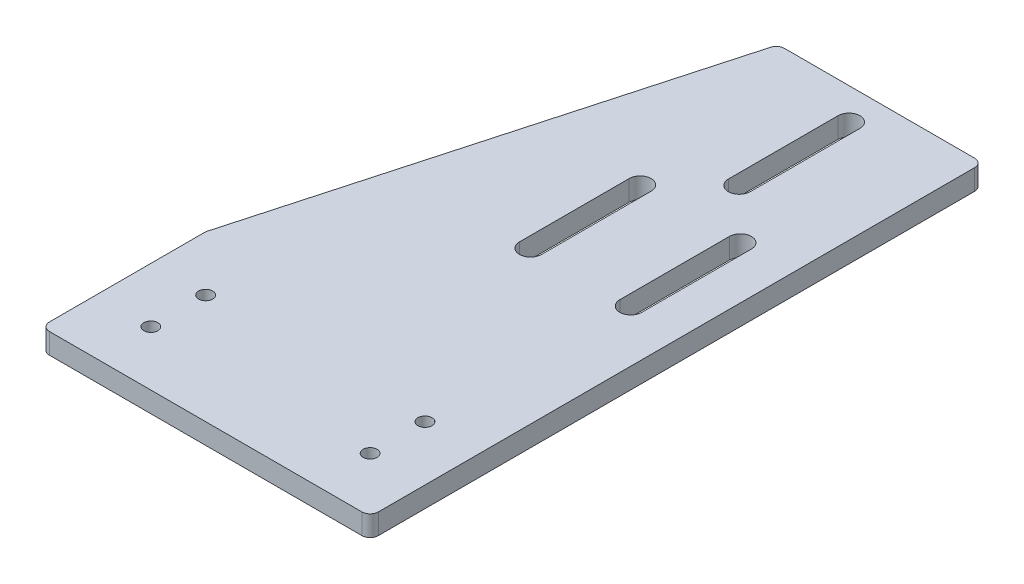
SolidWorks part; units mm, degrees
ref_plane "Front Plane" through (0, 0, 0) normal (0, 0, 1) x (1, 0, 0)
ref_plane "Top Plane" through (0, 0, 0) normal (0, 1, 0) x (1, 0, 0)
ref_plane "Right Plane" through (0, 0, 0) normal (1, 0, 0) x (0, 0, -1)
sketch "Sketch1" plane through (0, 0, 0) normal (0, 1, 0) x (1, 0, 0)
  line L0 (0, 0) -> (-23.1679, -73.5829) construction
  line L1 (-23.1679, -73.5829) -> (23.2637, -73.5829) construction
  line L2 (23.2637, -73.5829) -> (0, 0) construction
  line L3 (-40.0054, -96.3532) -> (36.1942, -96.0984) construction
  circle A0 centre (0, 0) radius 5.08
  circle A1 centre (-23.1679, -73.5829) radius 5.08
  circle A2 centre (23.2637, -73.5829) radius 5.08
  dimension "D6" = 10.16
  dimension "D1" = 35.022
  dimension "D2" = 77.144
  dimension "D3" = 77.1728
  dimension "D4" = 46.4316
  dimension "D5" = 72.455
  dimension "D7" = 76.2
  dimension "D8" = 72.523
sketch "Sketch3" plane through (0, 0, 0) normal (0, 1, 0) x (1, 0, 0)
  line L0 (-23.1679, -83.7429) -> (-23.1679, -32.9429) construction
  line L1 (-47.3937, 55.245) -> (47.3937, 55.245)
  line L2 (-47.3937, 55.245) -> (-47.3937, -228.6) construction
  line L3 (-105.0063, -228.6) -> (47.3937, -228.6)
  line L4 (47.3937, 55.245) -> (47.3937, -228.6)
  line L5 (-28.2479, -83.7429) -> (-28.2479, -32.9429)
  line L6 (-18.0879, -83.7429) -> (-18.0879, -32.9429)
  line L7 (23.2637, -83.7429) -> (23.2637, -32.9429) construction
  line L8 (18.1837, -83.7429) -> (18.1837, -32.9429)
  line L9 (28.3437, -83.7429) -> (28.3437, -32.9429)
  line L10 (0, -10.16) -> (0, 40.64) construction
  line L13 (-5.08, -10.16) -> (-5.08, 40.64)
  line L14 (5.08, -10.16) -> (5.08, 40.64)
  line L15 (-23.1679, -73.5829) -> (23.2637, -73.5829) construction
  line L16 (-47.3937, 55.245) -> (-105.0063, -152.4)
  line L17 (-105.0063, -152.4) -> (-105.0063, -228.6)
  line L18 (-105.0063, -165.1) -> (47.3937, -165.1) construction
  arc A0 (-28.2479, -83.7429) -> (-18.0879, -83.7429) centre (-23.1679, -83.7429) ccw
  arc A1 (-18.0879, -32.9429) -> (-28.2479, -32.9429) centre (-23.1679, -32.9429) ccw
  arc A2 (18.1837, -83.7429) -> (28.3437, -83.7429) centre (23.2637, -83.7429) ccw
  arc A3 (28.3437, -32.9429) -> (18.1837, -32.9429) centre (23.2637, -32.9429) ccw
  arc A6 (-5.08, -10.16) -> (5.08, -10.16) centre (0, -10.16) ccw
  arc A7 (5.08, 40.64) -> (-5.08, 40.64) centre (0, 40.64) ccw
  circle A8 centre (21.9937, -203.2) radius 3.2512
  circle A9 centre (21.9937, -177.8) radius 3.2512
  circle A10 centre (-79.6063, -177.8) radius 3.2512
  circle A11 centre (-79.6063, -203.2) radius 3.2512
  point P6 (-23.1679, -58.3429)
  point P14 (23.2637, -58.3429)
  point P22 (0, 15.24)
  point P31 (0, 55.245)
  point P32 (0, 45.72)
sketch "Sketch4" plane through (0, 0, 0) normal (0, 1, 0) x (1, 0, 0)
  line L0 (18.1837, -83.7429) -> (18.1837, -32.9429) construction
  line L1 (28.3437, -83.7429) -> (28.3437, -32.9429) construction
  line L2 (-5.08, -10.16) -> (-5.08, 40.64) construction
  line L3 (5.08, -10.16) -> (5.08, 40.64) construction
  line L4 (-28.2479, -83.7429) -> (-28.2479, -32.9429) construction
  line L5 (-18.0879, -83.7429) -> (-18.0879, -32.9429) construction
  line L6 (-47.3937, 55.245) -> (-105.0063, -152.4) construction
  line L7 (-105.0063, -152.4) -> (-105.0063, -228.6) construction
  line L8 (-105.0063, -228.6) -> (47.3937, -228.6) construction
  line L9 (47.3937, 55.245) -> (47.3937, -228.6) construction
  line L10 (-47.3937, 55.245) -> (47.3937, 55.245) construction
  line L11 (18.1837, -83.7429) -> (18.1837, -32.9429)
  line L12 (28.3437, -83.7429) -> (28.3437, -32.9429)
  line L13 (-5.08, -10.16) -> (-5.08, 40.64)
  line L14 (5.08, -10.16) -> (5.08, 40.64)
  line L15 (-28.2479, -83.7429) -> (-28.2479, -32.9429)
  line L16 (-18.0879, -83.7429) -> (-18.0879, -32.9429)
  line L17 (-48.1682, 52.4536) -> (-104.8676, -151.9001)
  line L18 (-105.0063, -152.9188) -> (-105.0063, -224.79)
  line L19 (-101.1963, -228.6) -> (43.5837, -228.6)
  line L20 (47.3937, 51.435) -> (47.3937, -224.79)
  line L21 (-44.4969, 55.245) -> (43.5837, 55.245)
  circle A0 centre (21.9937, -203.2) radius 3.2512 construction
  circle A1 centre (21.9937, -177.8) radius 3.2512 construction
  circle A2 centre (-79.6063, -203.2) radius 3.2512 construction
  circle A3 centre (-79.6063, -177.8) radius 3.2512 construction
  arc A4 (28.3437, -32.9429) -> (18.1837, -32.9429) centre (23.2637, -32.9429) ccw construction
  arc A5 (18.1837, -83.7429) -> (28.3437, -83.7429) centre (23.2637, -83.7429) ccw construction
  arc A6 (5.08, 40.64) -> (-5.08, 40.64) centre (0, 40.64) ccw construction
  arc A7 (-5.08, -10.16) -> (5.08, -10.16) centre (0, -10.16) ccw construction
  arc A8 (-18.0879, -32.9429) -> (-28.2479, -32.9429) centre (-23.1679, -32.9429) ccw construction
  arc A9 (-28.2479, -83.7429) -> (-18.0879, -83.7429) centre (-23.1679, -83.7429) ccw construction
  circle A10 centre (21.9937, -203.2) radius 3.2512
  circle A11 centre (21.9937, -177.8) radius 3.2512
  circle A12 centre (-79.6063, -203.2) radius 3.2512
  circle A13 centre (-79.6063, -177.8) radius 3.2512
  arc A14 (28.3437, -32.9429) -> (18.1837, -32.9429) centre (23.2637, -32.9429) ccw
  arc A15 (18.1837, -83.7429) -> (28.3437, -83.7429) centre (23.2637, -83.7429) ccw
  arc A16 (5.08, 40.64) -> (-5.08, 40.64) centre (0, 40.64) ccw
  arc A17 (-5.08, -10.16) -> (5.08, -10.16) centre (0, -10.16) ccw
  arc A18 (-18.0879, -32.9429) -> (-28.2479, -32.9429) centre (-23.1679, -32.9429) ccw
  arc A19 (-28.2479, -83.7429) -> (-18.0879, -83.7429) centre (-23.1679, -83.7429) ccw
  arc A20 (43.5837, -228.6) -> (47.3937, -224.79) centre (43.5837, -224.79) ccw
  arc A21 (-105.0063, -224.79) -> (-101.1963, -228.6) centre (-101.1963, -224.79) ccw
  arc A22 (-104.8676, -151.9001) -> (-105.0063, -152.9188) centre (-101.1963, -152.9188) ccw
  arc A23 (-48.1682, 52.4536) -> (-44.4969, 55.245) centre (-44.4969, 51.435) cw
  arc A24 (47.3937, 51.435) -> (43.5837, 55.245) centre (43.5837, 51.435) ccw
  dimension "D1" = 3.81
extrude "Boss-Extrude1" add sketch "Sketch4" along normal blind 9.525
sketch "Sketch9" plane through (0, 9.525, 0) normal (0, 1, 0) x (1, 0, 0)
  line L0 (-105.0063, -190.5) -> (47.3937, -190.5) construction
  line L1 (-105.0063, -152.9188) -> (-105.0063, -224.79) construction
  line L2 (47.3937, -224.79) -> (47.3937, 51.435) construction
  circle A0 centre (-79.6063, -177.8) radius 3.2512 construction
  circle A1 centre (-79.6063, -203.2) radius 3.2512 construction
  dimension "D1" = 12.7
  dimension "D2" = 12.7
sketch "Sketch10" plane through (0, 9.525, 0) normal (0, 1, 0) x (1, 0, 0)
  line L4 (35.9637, -78.74) -> (35.9637, 100.0394)
  line L5 (47.3937, -224.79) -> (47.3937, 51.435)
  line L6 (43.5837, 55.245) -> (-44.4969, 55.245)
  line L7 (-48.1682, 52.4536) -> (-104.8676, -151.9001)
  line L8 (-105.0063, -152.9188) -> (-105.0063, -224.79)
  line L9 (-101.1963, -228.6) -> (43.5837, -228.6)
  line L10 (47.3937, -224.79) -> (47.3937, 51.435)
  line L11 (43.5837, 55.245) -> (-44.4969, 55.245)
  line L12 (-48.1682, 52.4536) -> (-104.8676, -151.9001)
  line L13 (-105.0063, -152.9188) -> (-105.0063, -224.79)
  line L14 (-101.1963, -228.6) -> (43.5837, -228.6)
  line L15 (35.9637, 100.0394) -> (-6.7019, 100.0394)
  line L16 (-6.7019, 100.0394) -> (-45.8075, -78.74)
  line L17 (-45.8075, -78.74) -> (35.9637, -78.74)
  line L18 (28.3437, -83.7429) -> (28.3437, -32.9429) construction
  arc A0 (-18.0879, -32.9429) -> (-28.2479, -32.9429) centre (-23.1679, -32.9429) ccw construction
  arc A1 (5.08, 40.64) -> (-5.08, 40.64) centre (0, 40.64) ccw construction
  arc A2 (-5.08, -10.16) -> (5.08, -10.16) centre (0, -10.16) ccw construction
  arc A5 (43.5837, -228.6) -> (47.3937, -224.79) centre (43.5837, -224.79) ccw
  arc A6 (47.3937, 51.435) -> (43.5837, 55.245) centre (43.5837, 51.435) ccw
  arc A7 (-44.4969, 55.245) -> (-48.1682, 52.4536) centre (-44.4969, 51.435) ccw
  arc A8 (-104.8676, -151.9001) -> (-105.0063, -152.9188) centre (-101.1963, -152.9188) ccw
  arc A9 (-105.0063, -224.79) -> (-101.1963, -228.6) centre (-101.1963, -224.79) ccw
  arc A10 (43.5837, -228.6) -> (47.3937, -224.79) centre (43.5837, -224.79) ccw
  arc A11 (47.3937, 51.435) -> (43.5837, 55.245) centre (43.5837, 51.435) ccw
  arc A12 (-44.4969, 55.245) -> (-48.1682, 52.4536) centre (-44.4969, 51.435) ccw
  arc A13 (-104.8676, -151.9001) -> (-105.0063, -152.9188) centre (-101.1963, -152.9188) ccw
  arc A14 (-105.0063, -224.79) -> (-101.1963, -228.6) centre (-101.1963, -224.79) ccw
  dimension "D5" = 19.2398
  dimension "D6" = 68.58
  dimension "D2" = 7.62
  dimension "D3" = 78.74
  dimension "D4" = 12.3306
  dimension "D1" = 0
equation "\"D2@Sketch3\"=\"D1@Sketch3\""
